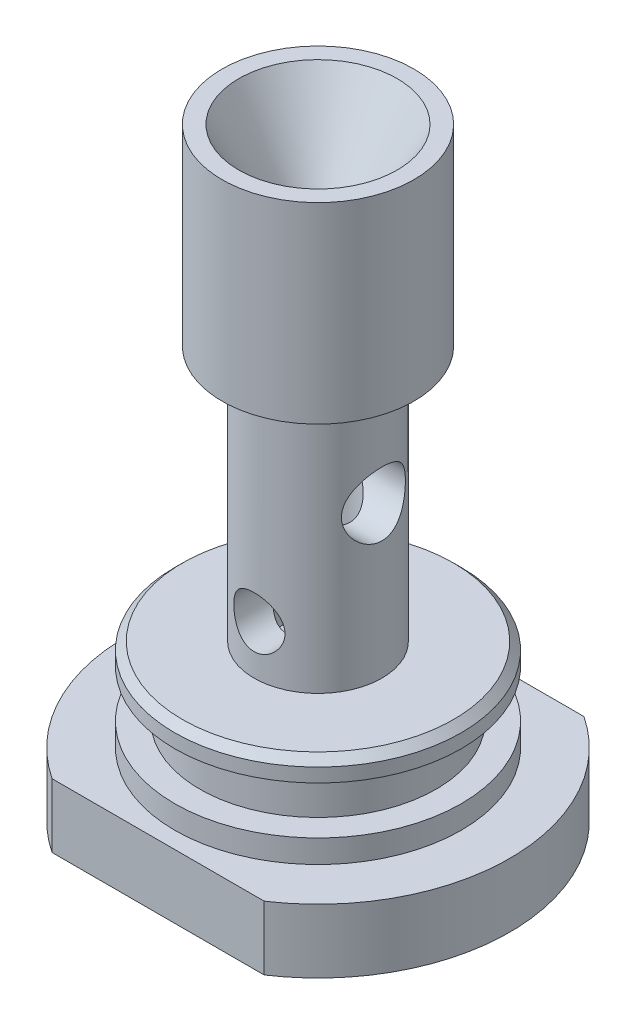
SolidWorks part; units mm, degrees
ref_plane "Front Plane" through (0, 0, 0) normal (0, 0, 1) x (1, 0, 0)
ref_plane "Top Plane" through (0, 0, 0) normal (0, 1, 0) x (1, 0, 0)
ref_plane "Right Plane" through (0, 0, 0) normal (1, 0, 0) x (0, 0, -1)
sketch "Sketch1" plane through (0, 0, 0) normal (0, 0, 1) x (1, 0, 0)
  line L0 (0, 0) -> (9.525, 0)
  line L1 (9.525, 0) -> (9.525, 3.175)
  line L2 (9.525, 3.175) -> (7.112, 3.175)
  line L3 (7.112, 6.6802) -> (7.112, 7.7469)
  line L4 (7.112, 7.7469) -> (3.175, 7.7469)
  line L5 (3.175, 7.7469) -> (3.175, 20.4469)
  line L6 (3.175, 20.4469) -> (4.7625, 20.4469)
  line L7 (4.7625, 20.4469) -> (4.7625, 29.9719)
  line L8 (7.112, 3.175) -> (7.112, 4.318)
  line L9 (7.112, 4.318) -> (5.8674, 4.318)
  line L10 (5.8674, 4.318) -> (5.8674, 6.6802)
  line L11 (5.8674, 6.6802) -> (7.112, 6.6802)
  line L12 (4.7625, 29.9719) -> (1.5875, 29.9719)
  line L13 (1.5875, 29.9719) -> (1.5875, 7.747)
  line L14 (1.5875, 7.747) -> (0, 7.747)
  line L15 (0, 7.747) -> (0, 0)
  line L16 (0, 0) -> (0, 32.2061) construction
  dimension "D1" = 9.525
  dimension "D5" = 2.3622
  dimension "D6" = 5.8674
  dimension "D8" = 3.175
  dimension "D9" = 12.7
  dimension "D10" = 4.7625
  dimension "D11" = 9.525
revolve "Revolve1" add sketch "Sketch1" angle 360 about L16
chamfer "Chamfer1" distance 0.381 angle 45 1 edges at (0, 7.7469, -7.112)
chamfer "Chamfer2" distance 4.064 angle 30 1 edges at (0, 29.9719, -1.5875)
sketch "Sketch2" plane through (0, 0, 0) normal (0, 0, 1) x (1, 0, 0)
  circle A0 centre (0, 10.16) radius 1.27
extrude "Cut-Extrude1" cut sketch "Sketch2" against normal through all and the other way through all
sketch "Sketch3" plane through (0, 0, 0) normal (1, 0, 0) x (0, 0, -1)
  circle A0 centre (0, 15.24) radius 1.5875
extrude "Cut-Extrude2" cut sketch "Sketch3" against normal through all and the other way through all
sketch "Sketch4" plane through (0, 0, 0) normal (0, -1, 0) x (1, 0, 0)
  line L1 (0, -7.9375) -> (12.7, -7.9375)
  line L2 (12.7, -7.9375) -> (12.7, 7.9375)
  line L3 (12.7, 7.9375) -> (-12.7, 7.9375)
  line L4 (-12.7, 7.9375) -> (-12.7, -7.9375)
  line L5 (-12.7, -7.9375) -> (0, -7.9375)
  dimension "D1" = 12.7
  dimension "D2" = 12.7
extrude "Cut-Extrude3" cut sketch "Sketch4" against normal through all flip side to cut
